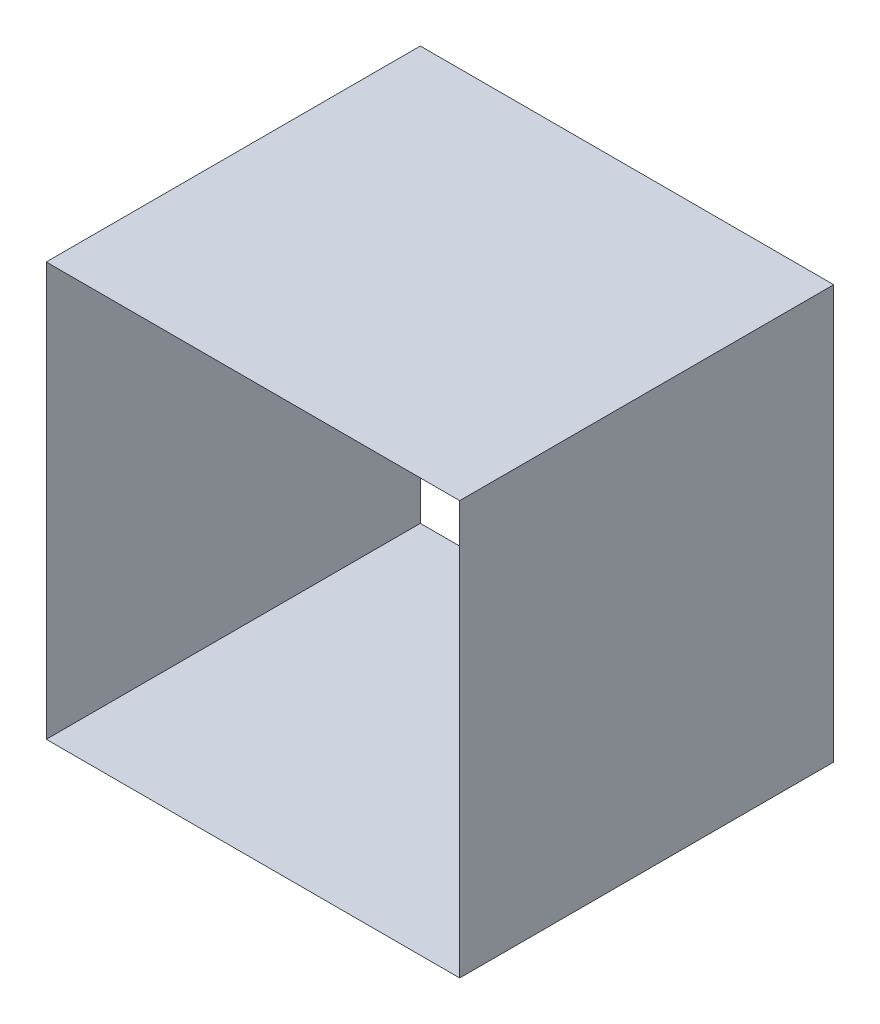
SolidWorks part; units mm, degrees
ref_plane "Front" through (0, 0, 0) normal (0, 0, 1) x (1, 0, 0)
ref_plane "Top" through (0, 0, 0) normal (0, 1, 0) x (1, 0, 0)
ref_plane "Right" through (0, 0, 0) normal (1, 0, 0) x (0, 0, -1)
sketch "Sketch1" plane through (0, 0, 0) normal (0, 0, 1) x (1, 0, 0)
  line L1 (0, 0) -> (0, 42)
  line L2 (0, 42) -> (42, 42)
  line L3 (42, 42) -> (42, 0)
  line L5 (0, 0) -> (42, 0)
  dimension "D1" = 42
surface "Surface-Extrude1" sketch "Sketch1" parameters "D1"=38
